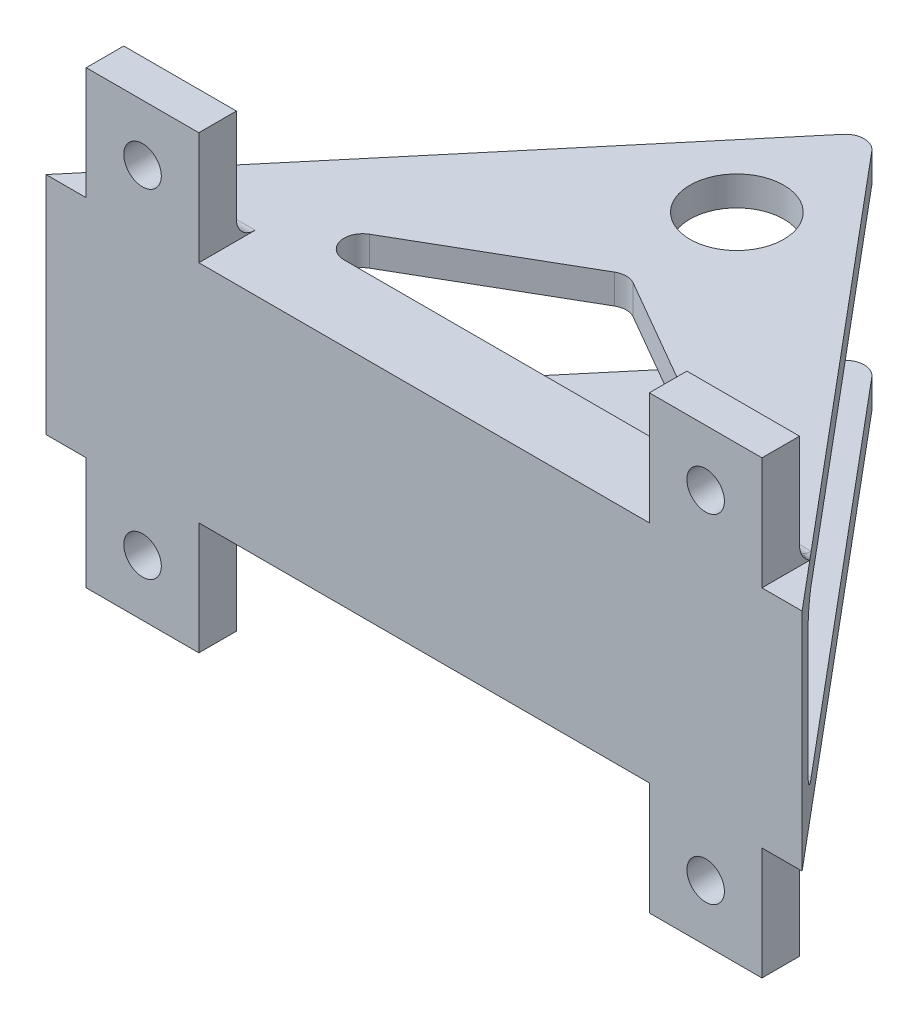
SolidWorks part; units mm, degrees
ref_plane "Front Plane" through (0, 0, 0) normal (0, 0, 1) x (1, 0, 0)
ref_plane "Top Plane" through (0, 0, 0) normal (0, 1, 0) x (1, 0, 0)
ref_plane "Right Plane" through (0, 0, 0) normal (1, 0, 0) x (0, 0, -1)
sketch "Sketch2" plane through (0, 0, 0) normal (0, 1, 0) x (1, 0, 0)
  line L0 (0, 0) -> (-63.9394, -76.2)
  line L1 (-63.9394, -76.2) -> (63.9394, -76.2)
  line L2 (63.9394, -76.2) -> (0, 0)
  circle A0 centre (0, -23.2994) radius 7.9375
  point P6 (0, -16.2094)
  point P7 (0, 0)
  point P8 (0, 0)
  point P9 (0, 0)
  dimension "D3" = 15.875
  dimension "D1" = 50
  dimension "D2" = 50
  dimension "D4" = 52.9006
  dimension "D5" = 76.2
  dimension "D6" = 23.2994
extrude "Boss-Extrude1" add sketch "Sketch2" along normal blind 38.1
sketch "Sketch3" plane through (0, 0, 0) normal (0, 0, 1) x (1, 0, 0)
  line L0 (0, 38.1) -> (0, 0) construction
  line L1 (58.8594, 33.1216) -> (-58.8594, 33.1216)
  line L2 (58.8594, 33.1216) -> (58.8594, 4.9784)
  line L3 (58.8594, 4.9784) -> (-58.8594, 4.9784)
  line L4 (-58.8594, 33.1216) -> (-58.8594, 4.9784)
  line L5 (58.8594, 33.1216) -> (-58.8594, 4.9784) construction
  line L6 (58.8594, 4.9784) -> (-58.8594, 33.1216) construction
  line L7 (-63.9394, 38.1) -> (-63.9394, 0) construction
  line L8 (0, 0) -> (-63.9394, 0) construction
  point P0 (0, 19.05)
  dimension "D1" = 5.08
  dimension "D2" = 4.9784
extrude "Cut-Extrude1" cut sketch "Sketch3" along normal offset from surface (69.85 mm away) 6.35
sketch "Sketch5" plane through (0, 38.1, 0) normal (0, 1, 0) x (1, 0, 0)
  line L0 (0, -41.503) -> (-38.1, -63.5)
  line L1 (-38.1, -63.5) -> (38.1, -63.5)
  line L2 (38.1, -63.5) -> (0, -41.503)
  point P2 (0, 0)
  point P4 (0, -63.5)
  dimension "D1" = 76.2
  dimension "D2" = 30
  dimension "D3" = 30
  dimension "D4" = 63.5
extrude "Cut-Extrude3" cut sketch "Sketch5" against normal up to surface (38.1 mm away)
sketch "Sketch6" plane through (0, 38.1, 0) normal (0, 1, 0) x (1, 0, 0)
  line L0 (0, 6.4381) -> (0, -82.5239) construction
  line L1 (-63.9394, -76.2) -> (63.9394, -76.2) construction
  line L2 (-57.15, -76.2) -> (-38.1, -76.2)
  line L3 (-57.15, -76.2) -> (-57.15, -69.85)
  line L4 (-57.15, -69.85) -> (-38.1, -69.85)
  line L5 (-38.1, -76.2) -> (-38.1, -69.85)
  line L6 (57.15, -69.85) -> (38.1, -69.85)
  line L7 (38.1, -76.2) -> (38.1, -69.85)
  line L8 (57.15, -76.2) -> (38.1, -76.2)
  line L9 (57.15, -76.2) -> (57.15, -69.85)
  dimension "D1" = 6.35
  dimension "D2" = 19.05
  dimension "D3" = 38.1
extrude "Boss-Extrude2" add sketch "Sketch6" along normal blind 19.05
sketch "Sketch8" plane through (0, 0, 0) normal (0, -1, 0) x (1, 0, 0)
  line L1 (57.15, 69.85) -> (38.1, 69.85)
  line L2 (57.15, 69.85) -> (57.15, 76.2)
  line L3 (57.15, 76.2) -> (38.1, 76.2)
  line L4 (38.1, 69.85) -> (38.1, 76.2)
  line L5 (-63.9394, 76.2) -> (63.9394, 76.2) construction
  line L6 (0, -5.4648) -> (0, 81.756) construction
  line L7 (-57.15, 76.2) -> (-38.1, 76.2)
  line L8 (-38.1, 69.85) -> (-38.1, 76.2)
  line L9 (-57.15, 69.85) -> (-38.1, 69.85)
  line L10 (-57.15, 69.85) -> (-57.15, 76.2)
  point P15 (0, 0)
  dimension "D1" = 6.35
  dimension "D2" = 19.05
  dimension "D3" = 38.1
extrude "Boss-Extrude3" add sketch "Sketch8" along normal blind 19.05
fillet "Fillet15" radius 3.175 14 edges at (47.625, 38.1, 69.85) (-47.625, 38.1, 69.85) (47.625, 0, 69.85) (-47.625, 0, 69.85) (0, 33.1216, 69.85) (0, 4.9784, 69.85) (38.1, 2.4892, 63.5) (38.1, 35.6108, 63.5) (-38.1, 2.4892, 63.5) (-38.1, 35.6108, 63.5) (0, 35.6108, 41.503) (0, 2.4892, 41.503) (0, 2.4892, 0) (0, 35.6108, 0)
sketch "Sketch9" plane through (0, 0, 0) normal (0, 0, 1) x (1, 0, 0)
  line L0 (63.9394, 19.05) -> (-63.9394, 19.05) construction
  line L1 (63.9394, 38.1) -> (63.9394, 0) construction
  line L2 (-63.9394, 38.1) -> (-63.9394, 0) construction
  line L3 (0, 57.6881) -> (0, -17.216) construction
  line L4 (57.15, 57.15) -> (38.1, 57.15) construction
  line L5 (57.15, 57.15) -> (57.15, 41.1383) construction
  circle A0 centre (47.625, -9.525) radius 3.175
  circle A1 centre (-47.625, -9.525) radius 3.175
  circle A2 centre (-47.625, 47.625) radius 3.175
  circle A3 centre (47.625, 47.625) radius 3.175
  dimension "D1" = 6.35
  dimension "D2" = 9.525
  dimension "D3" = 9.525
extrude "Cut-Extrude4" cut sketch "Sketch9" along normal up to surface (76.2 mm away)
